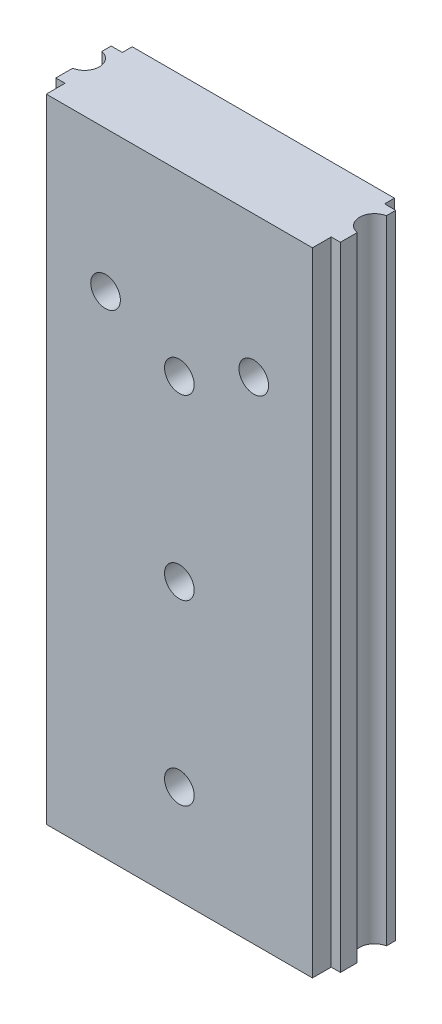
SolidWorks part; units mm, degrees
ref_plane "Plan de face" through (0, 0, 0) normal (0, 0, 1) x (1, 0, 0)
ref_plane "Plan de dessus" through (0, 0, 0) normal (0, 1, 0) x (1, 0, 0)
ref_plane "Plan de droite" through (0, 0, 0) normal (1, 0, 0) x (0, 0, -1)
sketch "Esquisse1" plane through (0, 0, 0) normal (0, 1, 0) x (1, 0, 0)
  line L1 (0, 0) -> (28.8, 0)
  line L2 (0, 0) -> (0, 8.5)
  line L3 (0, 8.5) -> (28.8, 8.5)
  line L4 (28.8, 0) -> (28.8, 8.5)
  dimension "D1" = 8.5
  dimension "D2" = 28.8
extrude "Extrusion1" add sketch "Esquisse1" along normal blind 64
sketch "Esquisse2" plane through (0, 64, 0) normal (0, 1, 0) x (-1, 0, 0)
  line L0 (0, -8.5) -> (0, 0) construction
  line L1 (0, -3.6) -> (0, -1.9)
  line L2 (0, -1.9) -> (-0.93, -1.9)
  line L3 (-0.93, -1.9) -> (-0.93, 0)
  line L4 (0, 0) -> (-28.8, 0) construction
  line L5 (-0.93, 0) -> (1.37, 0)
  line L6 (1.37, 0) -> (1.37, -8.5)
  line L7 (1.37, -8.5) -> (-1.13, -8.5)
  line L8 (-28.8, -8.5) -> (0, -8.5) construction
  line L9 (-1.13, -8.5) -> (-1.13, -7.5)
  line L10 (-1.13, -7.5) -> (0, -7.5)
  line L11 (0, -7.5) -> (0, -6.55)
  line L12 (-14.4, 0) -> (-14.4, -8.5) construction
  line L13 (-28.8, -7.5) -> (-28.8, -6.55)
  line L14 (-27.67, -7.5) -> (-28.8, -7.5)
  line L15 (-27.67, -8.5) -> (-27.67, -7.5)
  line L16 (-30.17, -8.5) -> (-27.67, -8.5)
  line L17 (-30.17, 0) -> (-30.17, -8.5)
  line L18 (-27.87, 0) -> (-30.17, 0)
  line L19 (-27.87, -1.9) -> (-27.87, 0)
  line L20 (-28.8, -1.9) -> (-27.87, -1.9)
  line L21 (-28.8, -3.6) -> (-28.8, -1.9)
  arc A0 (-28.8, -3.6) -> (-28.8, -6.55) centre (-29.0727, -5.075) cw
  arc A1 (0, -3.6) -> (0, -6.55) centre (0.2727, -5.075) ccw
  dimension "D7" = 1.5
  dimension "D1" = 1.37
  dimension "D2" = 2.3
  dimension "D3" = 2.5
  dimension "D4" = 1.7
  dimension "D5" = 0.95
  dimension "D6" = 1
  dimension "D8" = 1.9
extrude "Enlèv. mat.-Extru.1" cut sketch "Esquisse2" against normal through all
sketch "Esquisse3" plane through (0, 0, 0) normal (0, 0, 1) x (1, 0, 0)
  line L0 (14.4, 0) -> (14.4, 64) construction
  line L1 (0.93, 0) -> (27.87, 0) construction
  line L2 (0.93, 64) -> (27.87, 64) construction
  circle A0 centre (14.4, 10) radius 1.5
  circle A1 centre (14.4, 28) radius 1.5
  circle A2 centre (14.4, 46) radius 1.5
  dimension "D1" = 10
extrude "Enlèv. mat.-Extru.2" cut sketch "Esquisse3" against normal through all
sketch "Esquisse4" plane through (0, 0, -8.5) normal (0, 0, -1) x (-1, 0, 0)
  circle A0 centre (-21.93, 49.7) radius 1.5
  circle A1 centre (-6.93, 49.7) radius 1.5
extrude "Enlèv. mat.-Extru.3" cut sketch "Esquisse4" against normal through all
ref_plane "Plan1" through (14.4, 0, 0) normal (1, 0, 0) x (0, 0, -1)
